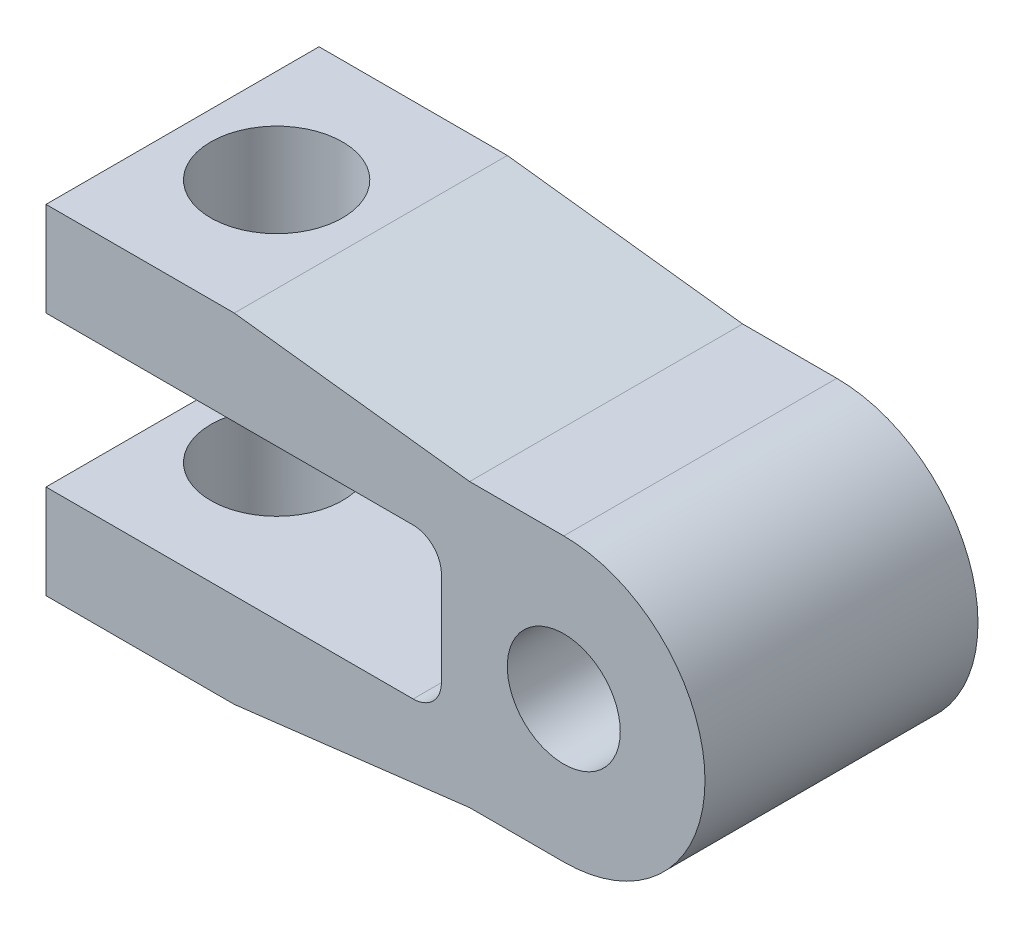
SolidWorks part; units mm, degrees
ref_plane "Plan1" through (0, 0, 0) normal (0, 0, 1) x (1, 0, 0)
ref_plane "Plan2" through (0, 0, 0) normal (0, 1, 0) x (1, 0, 0)
ref_plane "Plan3" through (0, 0, 0) normal (1, 0, 0) x (0, 0, -1)
sketch "Esquisse1" plane through (0, 0, 0) normal (0, 0, 1) x (1, 0, 0)
  line L0 (-90, 0) -> (30, 0) construction
  line L1 (-55, 18) -> (-55, 8)
  line L2 (-55, 18) -> (-35, 18)
  line L3 (-55, -18) -> (-35, -18)
  line L4 (0, 15) -> (-10, 15)
  line L5 (0, -15) -> (-10, -15)
  line L6 (-35, 18) -> (-10, 15)
  line L7 (-35, -18) -> (-10, -15)
  line L8 (-55, -8) -> (-55, -18)
  line L9 (-55, 8) -> (-13, 8)
  line L11 (-55, -8) -> (-13, -8)
  line L12 (-13, 8) -> (-13, -8)
  arc A0 (0, -15) -> (0, 15) centre (0, 0) ccw
  dimension "D1" = 30
  dimension "D2" = 36
  dimension "D3" = 18
  dimension "D4" = 55
  dimension "D5" = 20
  dimension "D6" = 20
  dimension "D7" = 10
  dimension "D8" = 10
  dimension "D9" = 42
  dimension "D10" = 16
  dimension "D11" = 8
extrude "Base-Extrusion" add sketch "Esquisse1" along normal blind 29
fillet "Congé1" radius 3
fillet "Congé2" radius 3
sketch "Esquisse2" plane through (0, 0, 29) normal (0, 0, 1) x (1, 0, 0)
  circle A0 centre (0, 0) radius 6
  dimension "D1" = 12
extrude "Enlèv. mat.-Extru.1" cut sketch "Esquisse2" against normal through all
sketch "Esquisse3" plane through (0, 18, 0) normal (0, 1, 0) x (-1, 0, 0)
  line L0 (35, 29) -> (55, 29) construction
  line L1 (55, 29) -> (55, 0) construction
  circle A0 centre (45, 14.5) radius 7
  dimension "D1" = 14
  dimension "D2" = 14.5
  dimension "D3" = 10
extrude "Enlèv. mat.-Extru.2" cut sketch "Esquisse3" against normal through all
